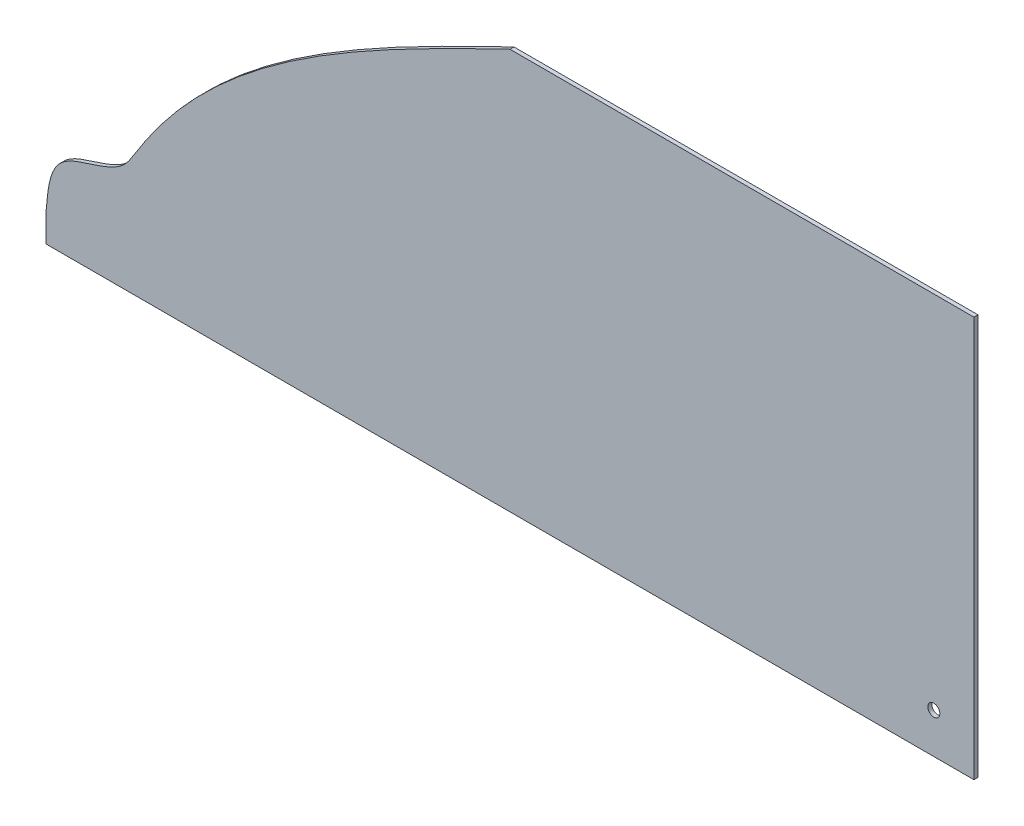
SolidWorks part; units mm, degrees
ref_plane "Front Plane" through (0, 0, 0) normal (0, 0, 1) x (1, 0, 0)
ref_plane "Top Plane" through (0, 0, 0) normal (0, 1, 0) x (1, 0, 0)
ref_plane "Right Plane" through (0, 0, 0) normal (1, 0, 0) x (0, 0, -1)
sketch "Sketch1" plane through (0, 0, 0) normal (0, 0, 1) x (1, 0, 0)
  line L1 (230.9808, 0) -> (0, 0)
  line L2 (230.9808, 0) -> (230.9808, 99.72)
  line L3 (230.9808, 99.72) -> (0, 99.72)
  line L4 (0, 0) -> (0, 99.72)
  circle A0 centre (220.9808, 10) radius 1.5
  dimension "D5" = 3
  dimension "D4" = 10
extrude "Extrude1" add sketch "Sketch1" along normal blind 1
sketch "Sketch2" plane through (0, 0, 1) normal (0, 0, 1) x (1, 0, 0)
  line L0 (0, 99.72) -> (0, 0) construction
  line L1 (230.9808, 99.72) -> (0, 99.72) construction
  spline S0 degree 3 poles (0, 6.9285) (0.3954, 11.6218) (1.3432, 22.8733) (17.5745, 22.7201) (41.3863, 63.7269) (79.3311, 82.157) (115.4904, 99.72) knots 0 0 0 0 0.083095 0.199208 0.236889 1 1 1 1
extrude "Cut-Extrude1" cut sketch "Sketch2" against normal through all and the other way through all
